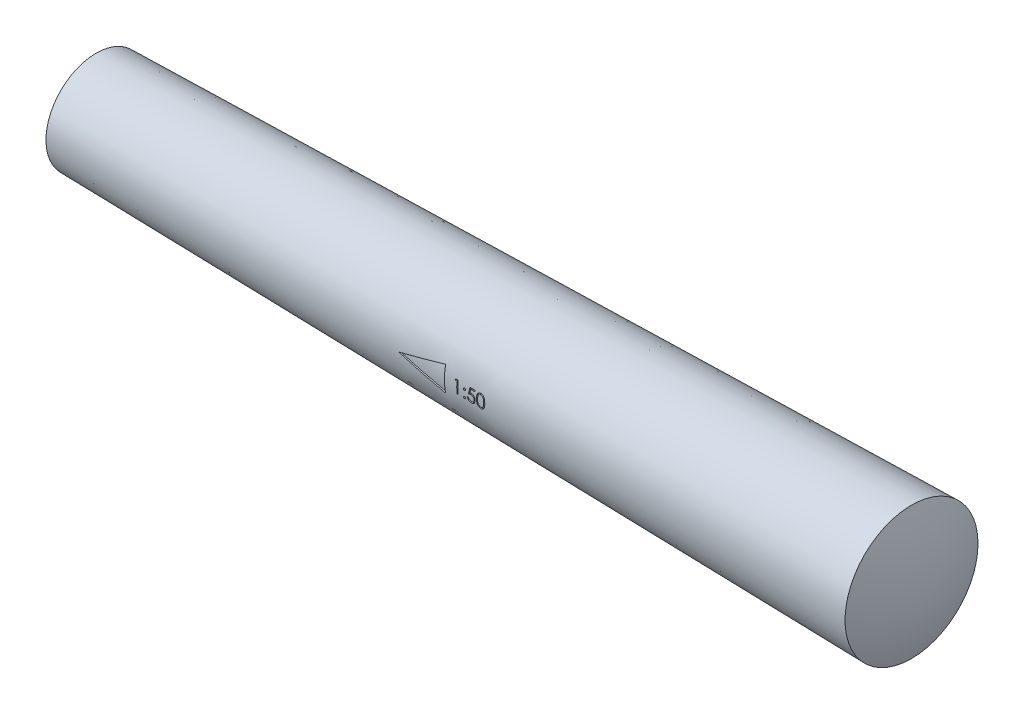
SolidWorks part; units mm, degrees
ref_plane "Front Plane" through (0, 0, 0) normal (0, 0, 1) x (1, 0, 0)
ref_plane "Top Plane" through (0, 0, 0) normal (0, 1, 0) x (1, 0, 0)
ref_plane "Right Plane" through (0, 0, 0) normal (1, 0, 0) x (0, 0, -1)
sketch "Sketch1" plane through (0, 0, 0) normal (1, 0, 0) x (0, 0, -1)
  circle A0 centre (0, 0) radius 4
  dimension "D1" = 8
extrude "Extrude1" add sketch "Sketch1" along normal mid plane 65
draft "Draft1" type of draft neutral plane draft angle 1.146 faces to draft 1 parameters "D1"=1.146
sketch "Sketch2" plane through (0, 0, 0) normal (0, 0, 1) x (1, 0, 0)
  line L0 (-32.5, 0) -> (-32.5, 4)
  line L1 (-32.5, 4) -> (-32.5, -4) construction
  line L2 (-32.5, 0) -> (-33.5, 0)
  line L3 (-33.5, 0) -> (-33.5, -4.65) construction
  line L4 (32.5, 0) -> (32.5, 5.3)
  line L5 (32.5, -5.3) -> (32.5, 5.3) construction
  line L6 (32.5, 0) -> (33.5, 0)
  line L7 (33.5, 0) -> (33.5, -4.65) construction
  line L8 (-32.5, -4) -> (32.5, -5.3) construction
  arc A0 (-33.5, 0) -> (-32.5, 4) centre (-25, 0) cw
  arc A1 (33.5, 0) -> (32.5, 5.3) centre (18.9548, 0) ccw
  point P14 (0, -4.65)
revolve "Revolve1" add sketch "Sketch2" angle 360 about L2
sketch "Sketch5" plane through (0, 0, 0) normal (0, 0, 1) x (1, 0, 0)
  line L0 (0, 4.65) -> (0, -4.65) construction
  line L1 (32.5, 5.3) -> (-32.5, 4) construction
  line L2 (-32.5, -4) -> (32.5, -5.3) construction
ref_plane "Plane2" through (0, 0, 0) normal (-0.02, 0, 0.9998) x (0.9998, 0, 0.02)
sketch "Sketch6" plane through (0, 0, 0) normal (-0.02, 0, 0.9998) x (0.9998, 0, 0.02)
  line L0 (0, 0) -> (0, 1)
  line L1 (0, 4.65) -> (0, -4.65) construction
  line L2 (0, 1) -> (-3.7321, 0)
  line L3 (-3.7321, 0) -> (0, -1)
  line L4 (0, -1) -> (0, 0)
  line L5 (0, -0.5) -> (4, -0.5) construction
  text T0 "1:50" font "Century Gothic" height 1
  dimension "D1" = 2
  dimension "D2" = 30
  dimension "D3" = 4
wrap "Wrap2" sketch "Sketch6" wrap type deboss source sketch "Sketch6" thickness 0.1 parameters "D1"=0.1
equation "\"D2@Sketch2\" = \"D1@Sketch2\""
